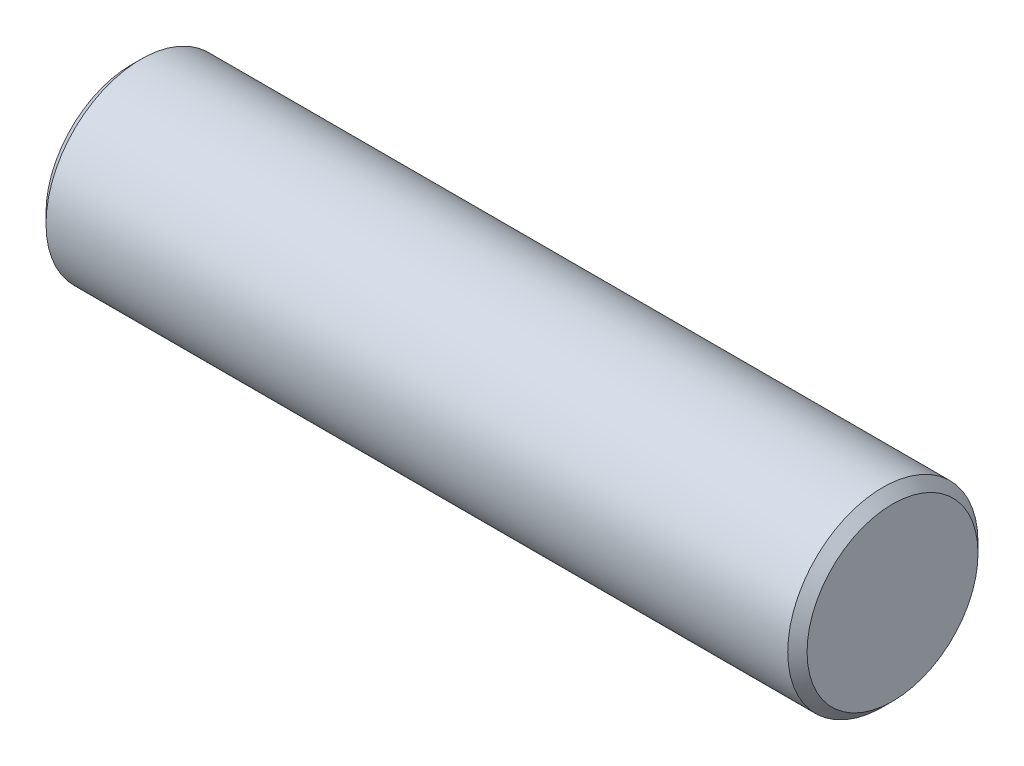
SolidWorks part; units mm, degrees
ref_plane "Front" through (0, 0, 0) normal (0, 0, 1) x (1, 0, 0)
ref_plane "Top" through (0, 0, 0) normal (0, 1, 0) x (1, 0, 0)
ref_plane "Right" through (0, 0, 0) normal (1, 0, 0) x (0, 0, -1)
sketch "xsection" plane through (0, 0, 0) normal (1, 0, 0) x (0, 0, -1)
  circle A0 centre (0, 0) radius 2.5
  dimension "diameter" = 5
extrude "extrusion" add sketch "xsection" along normal mid plane 20
chamfer "Chamfer1" distance 0.254 angle 45
